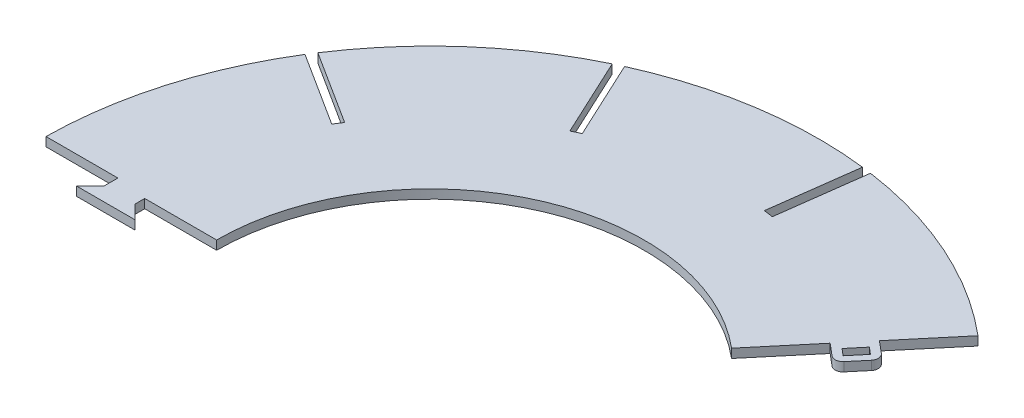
SolidWorks part; units mm, degrees
ref_plane "Alzado" through (0, 0, 0) normal (0, 0, 1) x (1, 0, 0)
ref_plane "Planta" through (0, 0, 0) normal (0, 1, 0) x (1, 0, 0)
ref_plane "Vista lateral" through (0, 0, 0) normal (1, 0, 0) x (0, 0, -1)
sketch "Croquis3" plane through (0, 0, 0) normal (0, 1, 0) x (1, 0, 0)
  line L0 (-837.7503, -412.5409) -> (-837.7503, -449.0409)
  line L1 (-572.7503, -424.0409) -> (-757.7503, -424.0409)
  line L2 (-837.7503, -449.0409) -> (-872.7503, -484.0409)
  line L3 (-872.7503, -484.0409) -> (-722.7503, -484.0409)
  line L4 (-722.7503, -484.0409) -> (-757.7503, -449.0409)
  line L5 (-757.7503, -449.0409) -> (-757.7503, -424.0409)
  line L6 (491.1313, 123.8168) -> (473.5123, 138.6009)
  line L7 (477.1265, 109.4601) -> (446.4847, 135.1716)
  line L8 (504.3356, 204.1156) -> (534.9773, 178.4041)
  line L9 (66.497, 345.7953) -> (90.2917, 342.6626)
  line L10 (505.6516, 176.9031) -> (523.2707, 162.119)
  line L11 (330.7829, -2.7164) -> (446.4847, 135.1716)
  line L12 (504.3356, 204.1156) -> (620.0373, 342.0036)
  line L13 (-339.3611, 283.3277) -> (-361.1125, 273.1849)
  line L14 (505.3031, 111.9252) -> (537.4425, 150.2274)
  line L15 (-669.8527, 2.4371) -> (-682.7412, -17.8085)
  line L16 (-682.7412, -17.8085) -> (-872.5286, 103.0994)
  line L17 (-682.7412, -17.8085) -> (-681.0281, -19.0237)
  line L21 (-361.1125, 273.1849) -> (-456.2442, 477.1955)
  line L23 (66.497, 345.7953) -> (95.87, 568.9048)
  line L27 (-669.846, 2.4329) -> (-859.6941, 123.3794)
  line L30 (491.1313, 123.8168) -> (523.2707, 162.119)
  line L31 (-339.3611, 283.3277) -> (-434.4928, 487.3383)
  line L33 (90.2917, 342.6626) -> (119.6733, 565.8377)
  line L34 (-837.7503, -413.0409) -> (-1022.6898, -413.0409)
  line L38 (473.5123, 138.6009) -> (505.6516, 176.9031)
  arc A0 (620.0373, 342.0036) -> (119.1689, 565.8374) centre (-22.7503, -424.0409) ccw
  arc A1 (330.7829, -2.7164) -> (-572.7503, -424.0409) centre (-22.7503, -424.0409) ccw
  arc A2 (505.3031, 111.9252) -> (477.1265, 109.4601) centre (489.9822, 124.781) cw
  arc A3 (537.4425, 150.2274) -> (534.9773, 178.4041) centre (522.1216, 163.0832) ccw
  arc A6 (96.3657, 568.8395) -> (-434.918, 487.0671) centre (-22.7503, -424.0409) ccw
  arc A8 (-455.7631, 477.3469) -> (-859.907, 122.9222) centre (-22.7503, -424.0409) ccw
  arc A9 (-872.5286, 103.0994) -> (-1022.6898, -413.0409) centre (-22.7503, -424.0409) ccw
  arc A13 (-669.8527, 2.4371) -> (-670.1277, 2.0195) centre (-22.7503, -424.0409) ccw
  arc A14 (-339.3645, 283.3349) -> (-339.8208, 283.1305) centre (-22.7503, -424.0409) ccw
  dimension "D1" = 185
  dimension "D2" = 150
  dimension "D4" = 25
extrude "Saliente-Extruir1" add sketch "Croquis3" along normal blind 23
